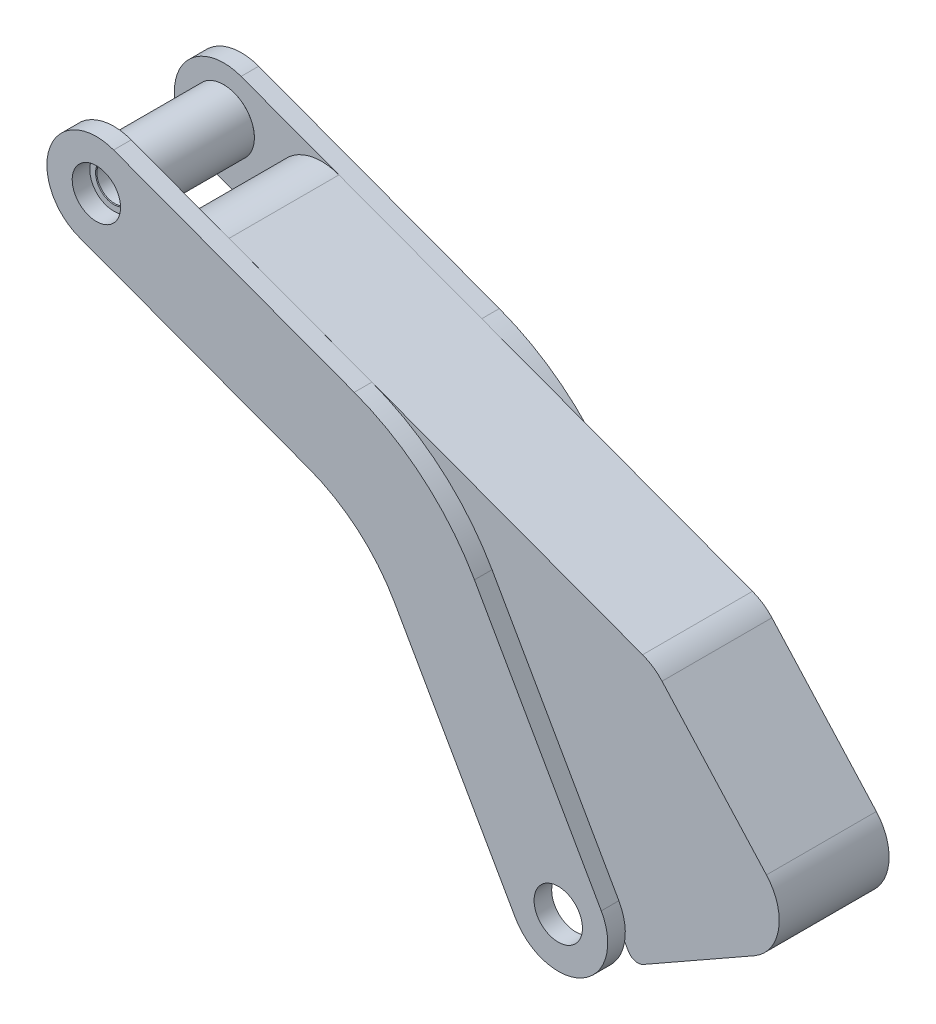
SolidWorks part; units mm, degrees
ref_plane "Ebene vorne" through (0, 0, 0) normal (0, 0, 1) x (1, 0, 0)
ref_plane "Ebene oben" through (0, 0, 0) normal (0, 1, 0) x (1, 0, 0)
ref_plane "Ebene rechts" through (0, 0, 0) normal (1, 0, 0) x (0, 0, -1)
imported_body "P001620-3-solid1"
imported_body "P001035-4-solid1"
imported_body "P001024-2-solid1"
imported_body "P001618-1-solid1"
other "Fläche löschen1"
